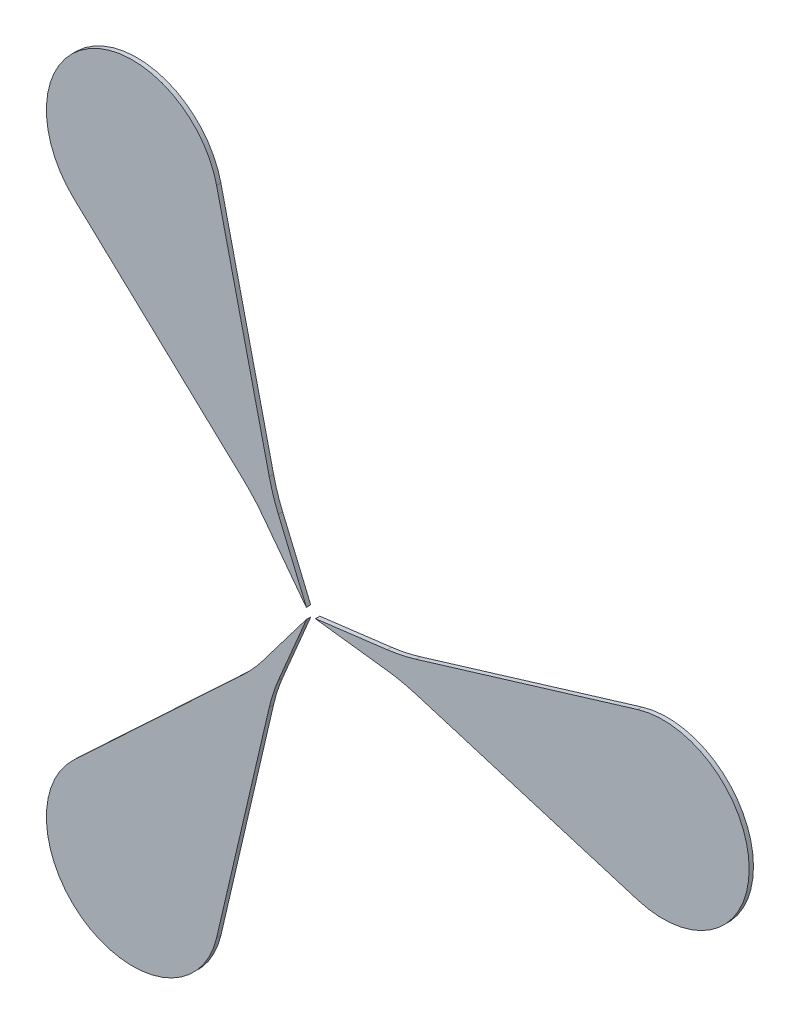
SolidWorks part; units mm, degrees
ref_plane "前基準面" through (0, 0, 0) normal (0, 0, 1) x (1, 0, 0)
ref_plane "上基準面" through (0, 0, 0) normal (0, 1, 0) x (1, 0, 0)
ref_plane "右基準面" through (0, 0, 0) normal (1, 0, 0) x (0, 0, -1)
sketch "草圖1" plane through (0, 0, 0) normal (0, 0, 1) x (1, 0, 0)
  line L0 (0.3574, 0.005) -> (20.1903, 2.4807) construction
  line L5 (0.3574, -0.005) -> (20.1903, -2.4807) construction
  line L6 (0.3574, 0.005) -> (4.5094, 0.5233)
  line L7 (0.3574, -0.005) -> (4.5094, -0.5233)
  line L8 (6.1751, 0.8773) -> (19.0478, 4.7845)
  line L9 (6.1751, -0.8773) -> (19.0478, -4.7845)
  line L10 (-0.183, -0.307) -> (-2.7079, -3.6436)
  line L11 (-3.8473, -4.9091) -> (-13.6674, -14.1037)
  line L12 (-2.3278, -5.7864) -> (-5.3804, -18.8881)
  line L13 (-0.1744, -0.312) -> (-1.8015, -4.1669)
  line L14 (-0.1744, 0.312) -> (-1.8015, 4.1669)
  line L15 (-2.3278, 5.7864) -> (-5.3804, 18.8881)
  line L16 (-3.8473, 4.9091) -> (-13.6674, 14.1037)
  line L17 (-0.183, 0.307) -> (-2.7079, 3.6436)
  line L18 (0, 0) -> (0.358, 0) construction
  line L19 (0, 0) -> (-0.179, 0.31) construction
  line L20 (0, 0) -> (-0.179, -0.31) construction
  circle A0 centre (0, 0) radius 0.353 construction
  arc A1 (0.3574, 0.005) -> (0.3574, -0.005) centre (0.358, 0) ccw
  circle A2 centre (20.5, 0) radius 2.5 construction
  arc A3 (19.0478, -4.7845) -> (19.0478, 4.7845) centre (20.5, 0) ccw
  arc A4 (4.5094, -0.5233) -> (6.1751, -0.8773) centre (3.2707, -10.4463) cw
  arc A5 (4.5094, 0.5233) -> (6.1751, 0.8773) centre (3.2707, 10.4463) ccw
  arc A6 (-0.1744, -0.312) -> (-0.183, -0.307) centre (-0.179, -0.31) ccw
  arc A7 (-2.7079, -3.6436) -> (-3.8473, -4.9091) centre (-10.6821, 2.3906) cw
  arc A8 (-13.6674, -14.1037) -> (-5.3804, -18.8881) centre (-10.25, -17.7535) ccw
  arc A9 (-1.8015, -4.1669) -> (-2.3278, -5.7864) centre (7.4114, -8.0556) ccw
  arc A10 (-0.183, 0.307) -> (-0.1744, 0.312) centre (-0.179, 0.31) ccw
  arc A11 (-1.8015, 4.1669) -> (-2.3278, 5.7864) centre (7.4114, 8.0556) cw
  arc A12 (-5.3804, 18.8881) -> (-13.6674, 14.1037) centre (-10.25, 17.7535) ccw
  arc A13 (-2.7079, 3.6436) -> (-3.8473, 4.9091) centre (-10.6821, -2.3906) ccw
  point P18 (5.3574, -0.6291)
  point P21 (5.3574, 0.6291)
  point P46 (0, 0)
  dimension "D1" = 0.706
  dimension "D2" = 0.01
  dimension "D3" = 5
  dimension "D4" = 20.5
  dimension "D6" = 10
  dimension "D7" = 10
  dimension "D8" = 3
  dimension "D5" = 5
  dimension "D9" = 120
  dimension "D10" = 120
  dimension "D12" = 14.231
  dimension "D13" = 14.231
  dimension "D14" = 14.231
extrude "填料-伸長2" add sketch "草圖1" along normal blind 0.25
